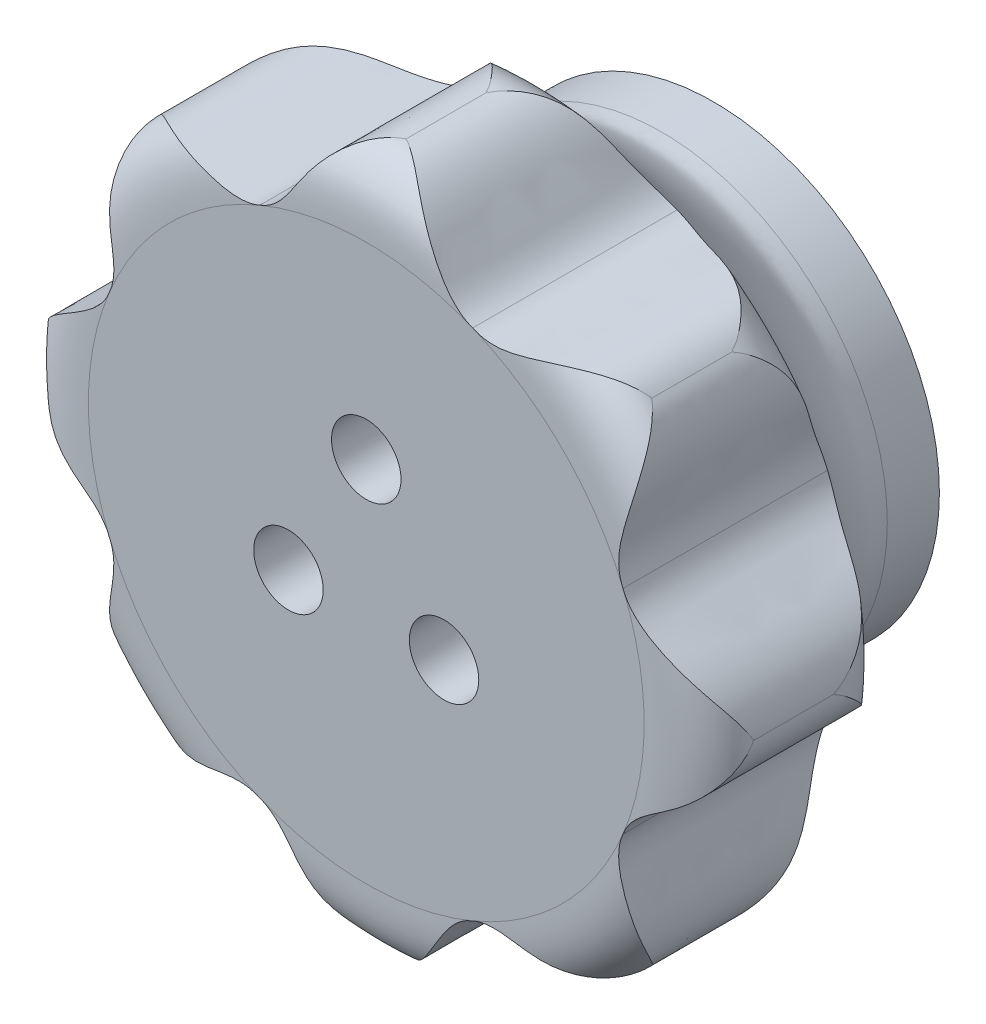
SolidWorks part; units mm, degrees
ref_plane "WL" through (0, 0, 0) normal (0, 0, 1) x (1, 0, 0)
ref_plane "BL" through (0, 0, 0) normal (0, 1, 0) x (1, 0, 0)
ref_plane "STA" through (0, 0, 0) normal (1, 0, 0) x (0, 0, -1)
sketch "Sketch3" plane through (0, 0, 0) normal (0, 1, 0) x (1, 0, 0)
  line L0 (0, 0) -> (0, -58.0502) construction
  line L1 (0, 0) -> (16.51, 0)
  line L2 (16.51, 0) -> (16.51, -3.81)
  line L3 (0, 0) -> (0, -25.4)
  line L4 (25.4, -22.5199) -> (25.4, -16.5289)
  line L5 (0, -25.4) -> (20.32, -25.4)
  line L6 (20.32, -25.4) -> (41.7512, -25.4) construction
  line L7 (25.4, -18.0028) -> (25.4, -22.5199) construction
  line L8 (20.32, -22.225) -> (32.9074, -22.225) construction
  spline S0 degree 3 poles (20.32, -25.4) (20.3747, -25.4) (21.4688, -25.4) (23.2643, -25.3332) (24.976, -23.9656) (25.4, -22.9331) (25.4, -22.5396) (25.4, -22.5199) knots 0 0 0 0 0.02501 0.500202 0.818758 0.990938 1 1 1 1
  spline S1 degree 3 poles (16.51, -3.81) (16.51, -3.8624) (16.51, -4.9099) (16.5455, -5.8846) (20.6051, -11.9988) (25.4, -12.9744) (25.4, -16.3596) (25.4, -16.5289) knots 0 0 0 0 0.006739 0.134782 0.552507 0.977625 1 1 1 1
  dimension "D1" = 16.51
  dimension "D2" = 25.4
  dimension "D3" = 20.32
  dimension "D4" = 3.81
  dimension "D5" = 25.4
  dimension "D6" = 3.175
revolve "Revolve1" add sketch "Sketch3" angle 360 about L0
sketch "Sketch4" plane through (0, 0, 0) normal (0, 0, -1) x (-1, 0, 0)
  line L0 (-5.6875, -3.2837) -> (0, 0) construction
  line L1 (0, 0) -> (5.6875, -3.2837) construction
  line L2 (0, 6.5674) -> (0, 0) construction
  circle A0 centre (0, 0) radius 6.5674 construction
  circle A1 centre (0, 6.5674) radius 2.3125
  circle A2 centre (-5.6875, -3.2837) radius 2.3125
  circle A3 centre (5.6875, -3.2837) radius 2.3125
  dimension "D1" = 16
  dimension "D4" = 6.75
  dimension "D2" = 120
  dimension "D3" = 120
extrude "Cut-Extrude1" cut sketch "Sketch4" against normal through all
sketch "Sketch5" plane through (0, 0, 0) normal (0, 0, -1) x (-1, 0, 0)
  circle A0 centre (0, 0) radius 2.65
  dimension "D1" = 5.3
extrude "Cut-Extrude2" cut sketch "Sketch5" against normal blind 5.08
sketch "Sketch6" plane through (0, 0, 25.4) normal (0, 0, 1) x (1, 0, 0)
  circle A0 centre (-5.6875, -3.2837) radius 2.3125 construction
  circle A1 centre (5.6875, -3.2837) radius 2.3125
  circle A2 centre (5.6875, -3.2837) radius 2.3125 construction
  circle A3 centre (0, 6.5674) radius 2.3125 construction
  circle A4 centre (-5.6875, -3.2837) radius 2.3125 construction
  circle A5 centre (0, 6.5674) radius 2.3125 construction
  circle A6 centre (0, 6.5674) radius 2.54
  circle A7 centre (5.6875, -3.2837) radius 2.54
  circle A8 centre (-5.6875, -3.2837) radius 2.54
  dimension "D2" = 5.08
  dimension "D1" = 0
extrude "Cut-Extrude3" cut sketch "Sketch6" against normal offset from surface (24.13 mm away) 1.27
sketch "Sketch7" plane through (0, 0, 0) normal (0, 0, 1) x (1, 0, 0)
  line L0 (0, 25.4) -> (0, 0) construction
  line L1 (7.7761, 18.7732) -> (0, 0) construction
  line L2 (4.4598, 22.4208) -> (0, 0) construction
  line L3 (0, 25.4) -> (4.404, 25.4) construction
  line L4 (7.7761, 18.7732) -> (8.6483, 18.412) construction
  line L5 (0, 25.4) -> (0, 27.3065)
  line L6 (17.9605, 17.9605) -> (20.5819, 20.1027)
  arc A2 (0, 27.3065) -> (20.5819, 20.1027) centre (-7.3473, -26.6898) cw
  circle A3 centre (0, 0) radius 22.86 construction
  circle A4 centre (0, 0) radius 20.32 construction
  spline S0 degree 3 poles (0, 25.4) (0.0913, 25.4) (1.9173, 25.4) (4.682, 22.665) (6.1736, 19.437) (7.6998, 18.8048) (7.7761, 18.7732) knots 0 0 0 0 0.026053 0.521061 0.976053 1 1 1 1
  spline S1 degree 3 poles (17.9605, 17.9605) (17.896, 18.0251) (16.6048, 19.3163) (12.7159, 19.3372) (9.3786, 18.1094) (7.8524, 18.7416) (7.7761, 18.7732) knots 0 0 0 0 0.026053 0.521061 0.976053 1 1 1 1
  point P50 (0, 0)
  point P65 (0, 0)
  dimension "D1" = 11.25
  dimension "D2" = 45.72
  dimension "D3" = 11.25
extrude "Cut-Extrude16" cut sketch "Sketch7" along normal through all
pattern_circular "CirPattern1" count 8 over 360 about axis through (0, 0, 5.08) along (0, 0, -1) of "Cut-Extrude16"
